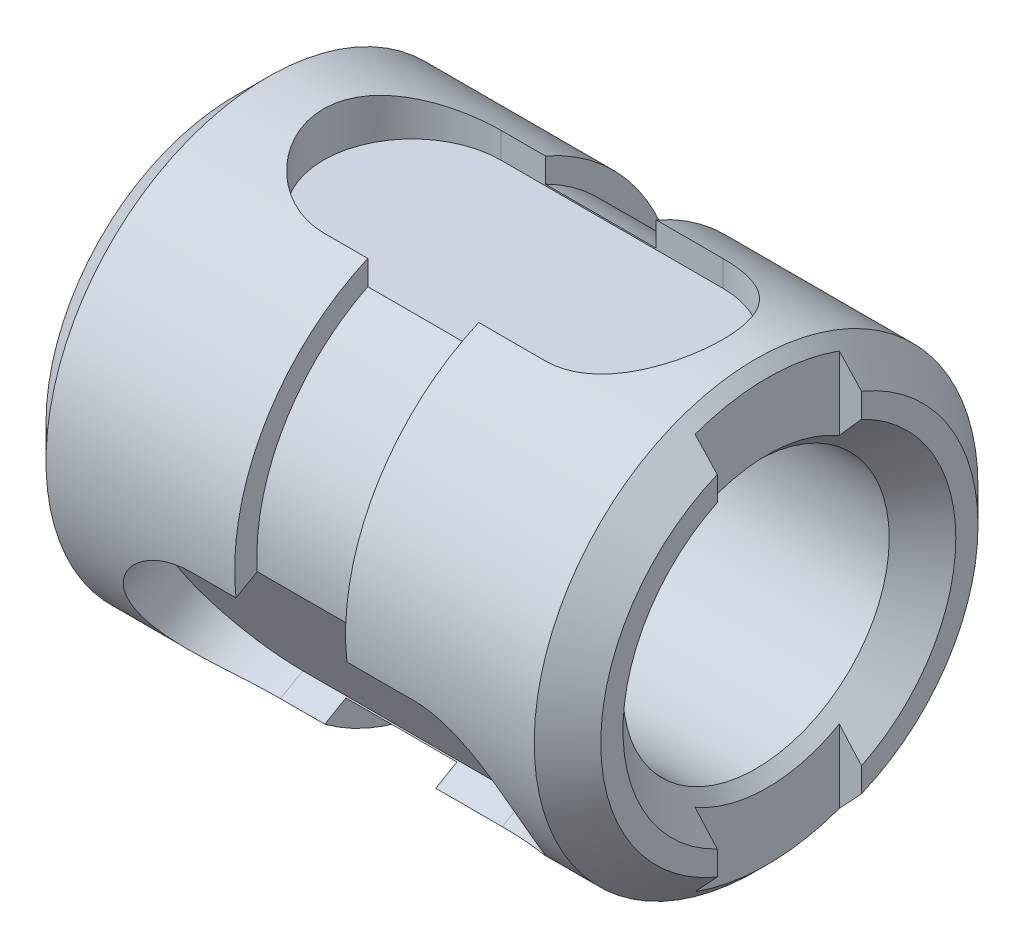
SolidWorks part; units mm, degrees
ref_plane "Front Plane" through (0, 0, 0) normal (0, 0, 1) x (1, 0, 0)
ref_plane "Top Plane" through (0, 0, 0) normal (0, 1, 0) x (1, 0, 0)
ref_plane "Right Plane" through (0, 0, 0) normal (1, 0, 0) x (0, 0, -1)
sketch "Sketch1" plane through (0, 0, 0) normal (0, 0, 1) x (1, 0, 0)
  line L0 (0, 0) -> (-29.1683, 0) construction
  line L1 (-23.5, 10) -> (-1.5, 10)
  line L2 (-25, 8.5) -> (-25, 7.5)
  line L3 (-23.5, 6) -> (-1.5, 6)
  line L4 (0, 8.5) -> (0, 7.5)
  line L5 (-1.5, 10) -> (0, 8.5)
  line L6 (-1.5, 6) -> (0, 7.5)
  line L7 (-25, 8.5) -> (-23.5, 10)
  line L8 (-25, 7.5) -> (-23.5, 6)
  point P0 (-25, 10)
  point P1 (0, 6)
  point P2 (-25, 6)
  point P3 (0, 10)
  dimension "D1" = 20
  dimension "D2" = 12
  dimension "D3" = 25
revolve "Revolve1" add sketch "Sketch1" angle 360 about L0
sketch "Sketch2" plane through (0, 0, 0) normal (0, 1, 0) x (1, 0, 0)
  line L0 (-17, 0) -> (-7, 0) construction
  line L1 (-17, 4) -> (-7, 4)
  line L2 (-17, -4) -> (-7, -4)
  line L6 (0, -8.5) -> (0, 8.5) construction
  arc A0 (-17, 4) -> (-17, -4) centre (-17, 0) ccw
  arc A1 (-7, -4) -> (-7, 4) centre (-7, 0) ccw
  point P2 (-12, 0)
  dimension "D1" = 4
  dimension "D3" = 7
  dimension "D2" = 10
extrude "Cut-Extrude1" cut sketch "Sketch2" along normal through all from offset 8
pattern_circular "CirPattern1" count 3 over 360 about axis through (0, 0, 0) along (1, 0, 0) of "Cut-Extrude1"
sketch3d "CAMWorksSketchPoint"
  point P0 (-333.1, -245.0099, -526)
  point P1 (358, 272.5, 373.5)
sketch "Sketch3" plane through (0, 0, 0) normal (0, 0, 1) x (1, 0, 0)
  line L0 (0, 0) -> (-25, 0) construction
  line L1 (-25, 8.5) -> (-25, -8.5) construction
  line L2 (-15, 17) -> (-10, 17)
  line L3 (-15, 17) -> (-15, 9)
  line L4 (-15, 9) -> (-10, 9)
  line L5 (-10, 17) -> (-10, 9)
  line L6 (-23.5, -10) -> (-1.5, -10) construction
  point P7 (-12.5, 9)
  point P12 (-12.5, -10)
  dimension "D2" = 5
  dimension "D3" = 18
  dimension "D4" = 8
revolve "Cut-Revolve1" cut sketch "Sketch3" angle 360 about L0
sketch "Sketch4" plane through (0, 0, 0) normal (1, 0, 0) x (0, 0, -1)
  line L1 (-3.25, -12.5) -> (3.25, -12.5)
  line L2 (-3.25, -12.5) -> (-3.25, 12.5)
  line L3 (-3.25, 12.5) -> (3.25, 12.5)
  line L4 (3.25, -12.5) -> (3.25, 12.5)
  line L5 (-3.25, -12.5) -> (3.25, 12.5) construction
  line L6 (-3.25, 12.5) -> (3.25, -12.5) construction
  point P0 (0, 0)
  dimension "D1" = 6.5
  dimension "D2" = 25
extrude "Cut-Extrude3" cut sketch "Sketch4" against normal blind 1
